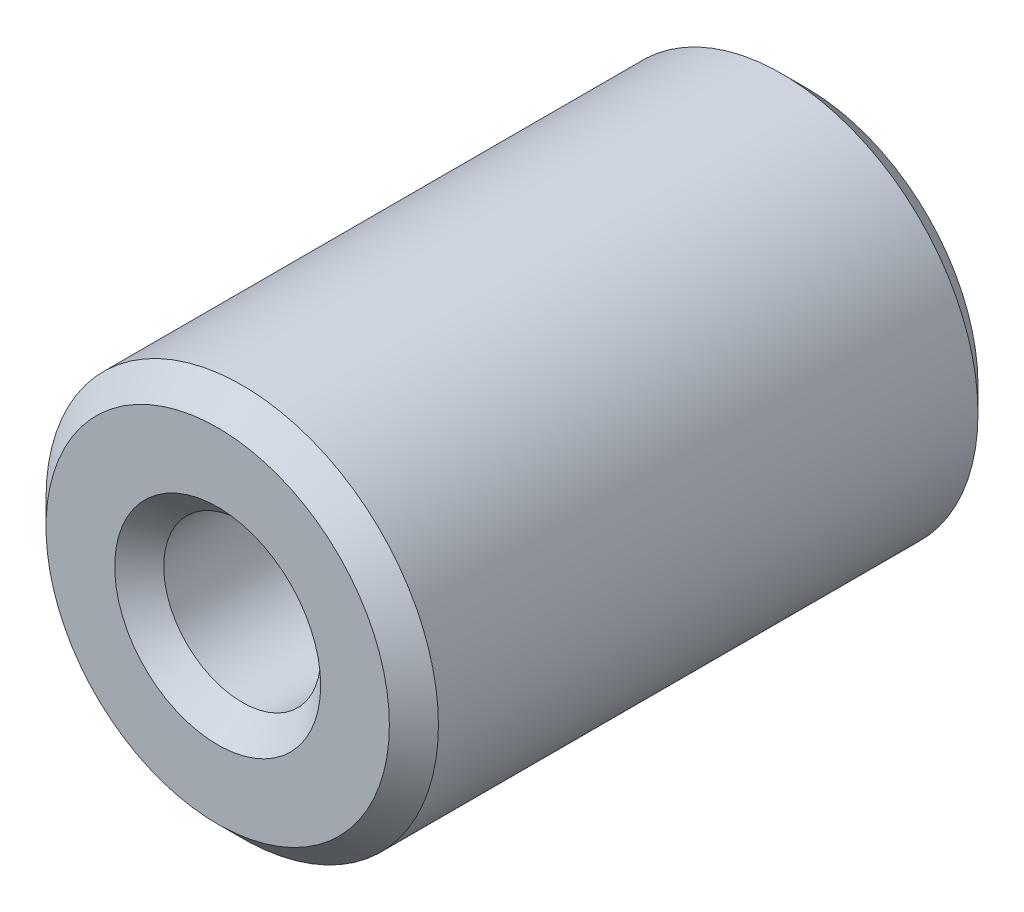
SolidWorks part; units mm, degrees
ref_plane "Спереди" through (0, 0, 0) normal (0, 0, 1) x (1, 0, 0)
ref_plane "Сверху" through (0, 0, 0) normal (0, 1, 0) x (1, 0, 0)
ref_plane "Справа" through (0, 0, 0) normal (1, 0, 0) x (0, 0, -1)
sketch "Эскиз1" plane through (0, 0, 0) normal (0, 0, 1) x (1, 0, 0)
  circle A0 centre (0, 0) radius 0.8
  circle A1 centre (0, 0) radius 2
  dimension "D1" = 4
  dimension "D2" = 1.6
extrude "Бобышка-Вытянуть1" add sketch "Эскиз1" along normal blind 6
chamfer "Фаска1" distance 0.25 angle 45 4 edges at (2, 0, 0) (2, 0, 6) (0.8, 0, 0) (0.8, 0, 6)
